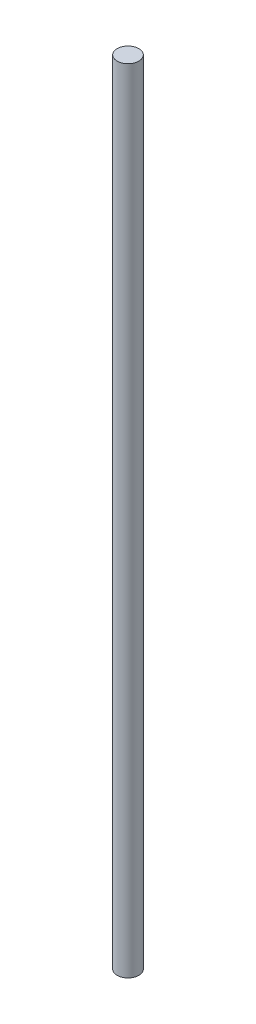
SolidWorks part; units mm, degrees
ref_plane "Front Plane" through (0, 0, 0) normal (0, 0, 1) x (1, 0, 0)
ref_plane "Top Plane" through (0, 0, 0) normal (0, 1, 0) x (1, 0, 0)
ref_plane "Right Plane" through (0, 0, 0) normal (1, 0, 0) x (0, 0, -1)
sketch "Sketch1" plane through (0, 0, 0) normal (0, 1, 0) x (1, 0, 0)
  circle A0 centre (0, 0) radius 4
  dimension "D1" = 8
extrude "Boss-Extrude1" add sketch "Sketch1" along normal blind 292.1
